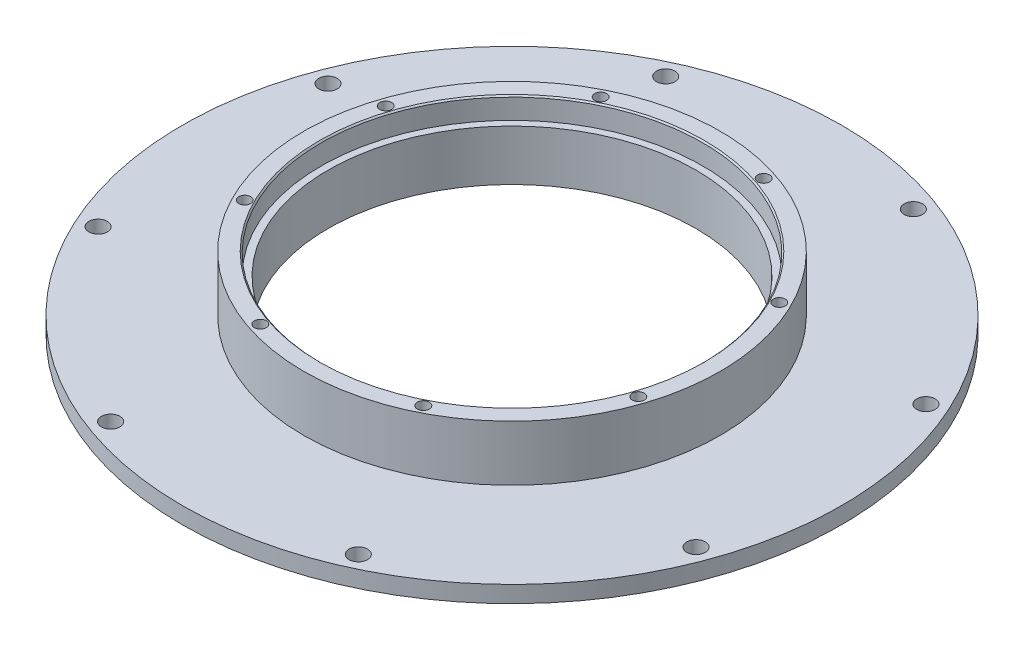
SolidWorks part; units mm, degrees
ref_plane "Front Plane" through (0, 0, 0) normal (0, 0, 1) x (1, 0, 0)
ref_plane "Top Plane" through (0, 0, 0) normal (0, 1, 0) x (1, 0, 0)
ref_plane "Right Plane" through (0, 0, 0) normal (1, 0, 0) x (0, 0, -1)
sketch "Sketch1" plane through (0, 0, 0) normal (0, 1, 0) x (1, 0, 0)
  circle A0 centre (0, 0) radius 120.65
extrude "Boss-Extrude1" add sketch "Sketch1" along normal blind 30.861
sketch "Sketch2" plane through (0, 30.861, 0) normal (0, 1, 0) x (1, 0, 0)
  circle A0 centre (0, 0) radius 67.31
  dimension "D1" = 134.62
extrude "Cut-Extrude2" cut sketch "Sketch2" against normal through all
sketch "Sketch4" plane through (0, 30.861, 0) normal (0, 1, 0) x (1, 0, 0)
  circle A0 centre (0, 0) radius 69.8627
  dimension "D1" = 139.7254
extrude "Cut-Extrude3" cut sketch "Sketch4" against normal blind 7.874
sketch "Sketch5" plane through (0, 30.861, 0) normal (0, 1, 0) x (1, 0, 0)
  circle A0 centre (0, 0) radius 76.2
extrude "Cut-Extrude4" cut sketch "Sketch5" against normal blind 20.32 flip side to cut
hole_wizard "1/4 Clearance Hole1" positions "Sketch6" profile "Sketch7" hole size "1/4" standard "ANSI Inch"
sketch "Sketch6" plane through (0, 10.541, 0) normal (0, 1, 0) x (1, 0, 0)
  circle A0 centre (0, 0) radius 76.2 construction
  point P0 (-39.7894, -107.1508)
  dimension "D1" = 114.3
sketch "Sketch7" plane through (-39.7894, 10.541, 107.1508) normal (1, 0, 0) x (0, 0, 1)
  line L0 (0, 0) -> (0, 10.541)
  line L1 (0, 10.541) -> (3.3782, 10.541)
  line L2 (3.3782, 10.541) -> (3.3782, 0)
  line L5 (3.3782, 0) -> (0, 0)
  line L11 (0, -6.35) -> (0, 107.95) construction
  dimension "Thru Hole Dia." = 6.7564
  dimension "Thru Hole Depth" = 10.541
pattern_circular "CirPattern1" count 8 over 360 about axis through (0, 0, 0) along (0, 1, 0) of "1/4 Clearance Hole1"
hole_wizard "Tapped Hole for #8-32 Helicoil1" positions "Sketch8" profile "Sketch9" tap size "#8-32" standard "Helicoil® Inch"
sketch "Sketch8" plane through (0, 30.861, 0) normal (0, 1, 0) x (1, 0, 0)
  circle A0 centre (0, 0) radius 69.8627 construction
  point P0 (-65.1571, -32.6906)
  dimension "D1" = 72.898
sketch "Sketch9" plane through (-65.1571, 30.861, 32.6906) normal (1, 0, 0) x (0, 0, 1)
  line L0 (0, 0) -> (0, 16.8396)
  line L1 (0, 16.8396) -> (2.1971, 15.5194)
  line L2 (2.1971, 15.5194) -> (2.1971, 0)
  line L5 (2.1971, 0) -> (0, 0)
  line L10 (0, 16.8396) -> (-2.1971, 15.5194) construction
  line L11 (0, -6.35) -> (0, 107.95) construction
  dimension "Tap Drill Dia." = 4.3942
  dimension "Tap Drill Depth" = 15.5194
  dimension "Drill Angle" = 118
pattern_circular "CirPattern2" count 8 over 360 about axis through (0, 0, 0) along (0, 1, 0) of "Tapped Hole for #8-32 Helicoil1"
chamfer "Chamfer2" distance 0.508 angle 45 1 edges at (0, 30.861, 69.8627)
sketch "Sketch12" plane through (0, 0, 0) normal (0, -1, 0) x (1, 0, 0)
  circle A0 centre (0, 0) radius 109.22
  dimension "D1" = 218.44
extrude "Cut-Extrude6" cut sketch "Sketch12" against normal blind 4.445 flip side to cut
chamfer "Chamfer3" distance 1.27 angle 45 1 edges at (0, 0, -109.22)
sketch "Sketch13" plane through (0, 0, 0) normal (0, -1, 0) x (1, 0, 0)
  circle A0 centre (0, 0) radius 105.664
extrude "Cut-Extrude7" cut sketch "Sketch13" against normal blind 4.445
